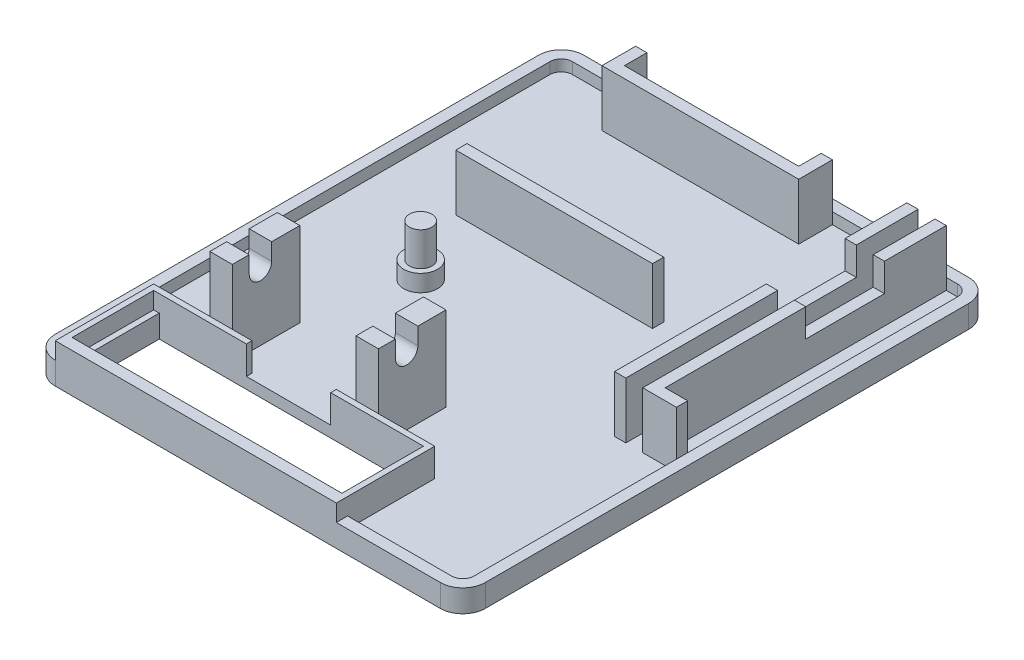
SolidWorks part; units mm, degrees
ref_plane "Plan de face" through (0, 0, 0) normal (0, 0, 1) x (1, 0, 0)
ref_plane "Plan de dessus" through (0, 0, 0) normal (0, 1, 0) x (1, 0, 0)
ref_plane "Plan de droite" through (0, 0, 0) normal (1, 0, 0) x (0, 0, -1)
sketch "Esquisse1" plane through (0, 8.2301, 0) normal (0, -1, 0) x (1, 0, 0)
  line L0 (29.8218, 30.8624) -> (-0.6782, 30.8624) construction
  line L1 (-0.6782, 29.3624) -> (-0.6782, 32.3624) construction
  line L2 (14.5718, 30.8624) -> (14.5718, 42.8624) construction
  line L3 (28.5718, 42.8624) -> (0.5718, 42.8624) construction
  line L4 (-2.9282, 16.8624) -> (32.0718, 18.8624) construction
  line L5 (-2.9282, 42.8624) -> (32.0718, 42.8624)
  line L6 (-2.9282, 42.8624) -> (-2.9282, 44.8624)
  line L7 (-2.9282, 44.8624) -> (32.0718, 44.8624)
  line L8 (32.0718, 42.8624) -> (32.0718, 44.8624)
  line L9 (-2.9282, 42.8624) -> (32.0718, 44.8624) construction
  line L10 (-2.9282, 44.8624) -> (32.0718, 42.8624) construction
  line L11 (-2.9282, 18.8624) -> (32.0718, 16.8624) construction
  line L12 (47.3218, 18.4124) -> (47.3218, 66.4124) construction
  line L13 (-0.9282, 16.8624) -> (30.0718, 16.8624)
  line L14 (-2.9282, 18.8624) -> (-2.9282, 16.8624)
  line L15 (-2.9282, 18.8624) -> (32.0718, 18.8624)
  line L16 (-2.9282, 16.8624) -> (-2.9282, 12.8624)
  line L17 (-2.9282, 12.8624) -> (-0.9282, 12.8624)
  line L18 (-0.9282, 12.8624) -> (-0.9282, 16.8624)
  line L19 (30.0718, 12.8624) -> (30.0718, 16.8624)
  line L20 (32.0718, 12.8624) -> (30.0718, 12.8624)
  line L21 (32.0718, 16.8624) -> (32.0718, 12.8624)
  line L22 (32.0718, 18.8624) -> (32.0718, 16.8624)
  line L23 (45.3218, 12.8624) -> (47.3218, 12.8624)
  line L24 (45.3218, 12.8624) -> (45.3218, 64.8624)
  line L25 (45.3218, 64.8624) -> (47.3218, 64.8624)
  line L26 (47.3218, 12.8624) -> (47.3218, 64.8624)
  line L27 (48.8218, 67.4124) -> (48.8218, 17.4124) construction
  line L28 (47.3218, 67.4124) -> (50.3218, 67.4124) construction
  line L29 (50.3218, 17.4124) -> (47.3218, 17.4124) construction
  line L30 (50.3218, 12.8624) -> (50.3218, 64.8624)
  line L31 (52.3218, 64.8624) -> (50.3218, 64.8624)
  line L32 (52.3218, 12.8624) -> (52.3218, 62.8624)
  line L33 (52.3218, 12.8624) -> (50.3218, 12.8624)
  line L35 (52.3218, 64.8624) -> (56.3218, 64.8624)
  line L37 (52.3218, 62.8624) -> (56.3218, 62.8624)
  line L38 (56.3218, 64.8624) -> (56.3218, 62.8624)
  point P9 (14.5718, 43.8624)
  point P18 (14.5718, 17.8624)
  dimension "D1" = 35
  dimension "D2" = 2
  dimension "D3" = 2
  dimension "D4" = 6
  dimension "D5" = 2
  dimension "D6" = 2
  dimension "D7" = 52
  dimension "D8" = 2
  dimension "D9" = 6
extrude "Boss.-Extru.1" add sketch "Esquisse1" against normal blind 10
sketch "Esquisse2" plane through (52.3218, 0, 0) normal (1, 0, 0) x (0, 0, -1)
  line L0 (-12.8624, 18.2301) -> (-62.8624, 18.2301) construction
  line L1 (-37.8624, 18.2301) -> (-23.8624, 18.2301)
  line L2 (-37.8624, 18.2301) -> (-37.8624, 13.2301)
  line L3 (-37.8624, 13.2301) -> (-23.8624, 13.2301)
  line L4 (-23.8624, 18.2301) -> (-23.8624, 13.2301)
  line L5 (-12.8624, 18.2301) -> (-12.8624, 8.2301) construction
  dimension "D1" = 11
  dimension "D2" = 14
  dimension "D3" = 5
extrude "Enlèv. mat.-Extru.1" cut sketch "Esquisse2" against normal up to surface (7 mm away)
ref_plane "Plan1" through (49.3218, 0, 0) normal (1, 0, 0) x (0, 0, -1)
sketch "Esquisse3" plane through (0, 8.2301, 0) normal (0, -1, 0) x (1, 0, 0)
  line L0 (50.3218, 12.8624) -> (52.3218, 12.8624) construction
  line L1 (54.3218, 12.8624) -> (-14.1782, 12.8624)
  line L2 (56.3218, 14.8624) -> (56.3218, 100.8624)
  line L3 (54.3218, 102.8624) -> (-14.1782, 102.8624)
  line L4 (-16.1782, 14.8624) -> (-16.1782, 100.8624)
  line L5 (56.3218, 62.8624) -> (56.3218, 64.8624) construction
  line L6 (54.3218, 10.8624) -> (-14.1782, 10.8624)
  line L7 (-18.1782, 14.8624) -> (-18.1782, 100.8624)
  line L8 (54.3218, 104.8624) -> (-14.1782, 104.8624)
  line L9 (58.3218, 14.8624) -> (58.3218, 100.8624)
  arc A0 (54.3218, 12.8624) -> (56.3218, 14.8624) centre (54.3218, 14.8624) ccw
  arc A1 (56.3218, 100.8624) -> (54.3218, 102.8624) centre (54.3218, 100.8624) ccw
  arc A2 (-14.1782, 102.8624) -> (-16.1782, 100.8624) centre (-14.1782, 100.8624) ccw
  arc A3 (-16.1782, 14.8624) -> (-14.1782, 12.8624) centre (-14.1782, 14.8624) ccw
  arc A4 (-18.1782, 14.8624) -> (-14.1782, 10.8624) centre (-14.1782, 14.8624) ccw
  arc A5 (-14.1782, 104.8624) -> (-18.1782, 100.8624) centre (-14.1782, 100.8624) ccw
  arc A6 (58.3218, 100.8624) -> (54.3218, 104.8624) centre (54.3218, 100.8624) ccw
  arc A7 (54.3218, 10.8624) -> (58.3218, 14.8624) centre (54.3218, 14.8624) ccw
  dimension "D3" = 2
  dimension "D1" = 72.5
  dimension "D2" = 90
  dimension "D4" = 2
extrude "Boss.-Extru.2" add sketch "Esquisse3" against normal blind 2 separate body
sketch "Esquisse4" plane through (0, 8.2301, 0) normal (0, -1, 0) x (1, 0, 0)
  line L0 (54.3218, 104.8624) -> (-14.1782, 104.8624) construction
  line L1 (54.3218, 104.8624) -> (-14.1782, 104.8624)
  line L2 (-18.1782, 100.8624) -> (-18.1782, 14.8624) construction
  line L3 (-18.1782, 100.8624) -> (-18.1782, 14.8624)
  line L4 (58.3218, 14.8624) -> (58.3218, 100.8624) construction
  line L5 (58.3218, 14.8624) -> (58.3218, 100.8624)
  line L6 (-14.1782, 10.8624) -> (54.3218, 10.8624) construction
  line L7 (-14.1782, 10.8624) -> (54.3218, 10.8624)
  arc A0 (-14.1782, 104.8624) -> (-18.1782, 100.8624) centre (-14.1782, 100.8624) ccw construction
  arc A1 (-14.1782, 104.8624) -> (-18.1782, 100.8624) centre (-14.1782, 100.8624) ccw
  arc A2 (58.3218, 100.8624) -> (54.3218, 104.8624) centre (54.3218, 100.8624) ccw construction
  arc A3 (58.3218, 100.8624) -> (54.3218, 104.8624) centre (54.3218, 100.8624) ccw
  arc A4 (-18.1782, 14.8624) -> (-14.1782, 10.8624) centre (-14.1782, 14.8624) ccw construction
  arc A5 (-18.1782, 14.8624) -> (-14.1782, 10.8624) centre (-14.1782, 14.8624) ccw
  arc A6 (54.3218, 10.8624) -> (58.3218, 14.8624) centre (54.3218, 14.8624) ccw construction
  arc A7 (54.3218, 10.8624) -> (58.3218, 14.8624) centre (54.3218, 14.8624) ccw
extrude "Boss.-Extru.3" add sketch "Esquisse4" along normal blind 2
sketch "Esquisse5" plane through (0, 10.2301, 0) normal (0, 1, 0) x (1, 0, 0)
  line L0 (54.3218, -104.8624) -> (-14.1782, -104.8624) construction
  line L1 (-14.1782, -87.3624) -> (35.8218, -87.3624)
  line L2 (-14.1782, -87.3624) -> (-14.1782, -104.8624)
  line L3 (-14.1782, -104.8624) -> (35.8218, -104.8624)
  line L4 (35.8218, -87.3624) -> (35.8218, -104.8624)
  line L5 (54.3218, -102.8624) -> (-14.1782, -102.8624) construction
  line L6 (-13.1782, -88.3624) -> (34.8218, -88.3624)
  line L7 (-13.1782, -88.3624) -> (-13.1782, -102.8624)
  line L8 (-13.1782, -102.8624) -> (34.8218, -102.8624)
  line L9 (34.8218, -88.3624) -> (34.8218, -102.8624)
  line L11 (-16.1782, -100.8624) -> (-16.1782, -14.8624) construction
  dimension "D1" = 50
  dimension "D2" = 17.5
  dimension "D3" = 1
  dimension "D4" = 1
  dimension "D5" = 1
  dimension "D6" = 2
extrude "Boss.-Extru.4" add sketch "Esquisse5" along normal blind 3 and the other way blind 2
sketch "Esquisse6" plane through (0, 8.2301, 0) normal (0, 1, 0) x (1, 0, 0)
  line L0 (-13.1782, -102.8624) -> (34.8218, -102.8624) construction
  line L1 (33.8218, -101.8624) -> (-12.1782, -101.8624)
  line L2 (33.8218, -101.8624) -> (33.8218, -87.3624)
  line L4 (-12.1782, -101.8624) -> (-12.1782, -87.3624)
  line L5 (34.8218, -102.8624) -> (34.8218, -88.3624) construction
  line L6 (-13.1782, -88.3624) -> (-13.1782, -102.8624) construction
  line L7 (-13.1782, -102.8624) -> (34.8218, -102.8624)
  line L8 (34.8218, -102.8624) -> (34.8218, -87.3624)
  line L9 (-13.1782, -87.3624) -> (-13.1782, -102.8624)
  line L10 (-13.1782, -87.3624) -> (-12.1782, -87.3624)
  line L11 (35.8218, -87.3624) -> (-14.1782, -87.3624) construction
  line L12 (33.8218, -87.3624) -> (34.8218, -87.3624)
  dimension "D1" = 1
  dimension "D2" = 1
  dimension "D3" = 1
extrude "Boss.-Extru.7" add sketch "Esquisse6" along normal up to vertex
sketch "Esquisse7" plane through (0, 0, 87.3624) normal (0, 0, -1) x (-1, 0, 0)
  line L0 (-35.8218, 13.2301) -> (14.1782, 13.2301) construction
  line L1 (-3.3218, 13.2301) -> (-18.3218, 13.2301)
  line L2 (-3.3218, 13.2301) -> (-3.3218, 8.2301)
  line L3 (-35.8218, 8.2301) -> (14.1782, 8.2301) construction
  line L4 (-18.3218, 13.2301) -> (-18.3218, 8.2301)
  line L6 (-35.8218, 8.2301) -> (-35.8218, 13.2301) construction
  line L7 (14.1782, 8.2301) -> (14.1782, 13.2301) construction
  line L8 (-18.3218, 8.2301) -> (-3.3218, 8.2301)
  dimension "D1" = 17.5
  dimension "D2" = 17.5
extrude "Enlèv. mat.-Extru.2" cut sketch "Esquisse7" against normal blind 2
sketch "Esquisse9" plane through (0, 13.2301, 0) normal (0, 1, 0) x (1, 0, 0)
  line L0 (-12.1782, -101.8624) -> (-12.1782, -88.3624) construction
  line L1 (-13.1782, -88.3624) -> (34.8218, -88.3624)
  line L2 (-13.1782, -88.3624) -> (-13.1782, -102.8624)
  line L3 (-13.1782, -102.8624) -> (34.8218, -102.8624)
  line L4 (34.8218, -88.3624) -> (34.8218, -102.8624)
  line L5 (35.8218, -102.8624) -> (35.8218, -87.3624) construction
  line L6 (33.8218, -101.8624) -> (-12.1782, -101.8624) construction
  line L7 (33.8218, -88.3624) -> (18.3218, -88.3624) construction
  dimension "D1" = 1
  dimension "D2" = 1
  dimension "D3" = 1
extrude "Enlèv. mat.-Extru.3" cut sketch "Esquisse9" against normal up to surface (3 mm away)
sketch "Esquisse10" plane through (0, 8.2301, 0) normal (0, 1, 0) x (1, 0, 0)
  line L0 (-12.1782, -101.8624) -> (33.8218, -101.8624) construction
  line L1 (-12.1782, -101.8624) -> (33.8218, -101.8624)
  line L2 (-12.1782, -88.3624) -> (-12.1782, -101.8624) construction
  line L3 (-12.1782, -88.3624) -> (-12.1782, -101.8624)
  line L4 (33.8218, -101.8624) -> (33.8218, -88.3624) construction
  line L5 (33.8218, -101.8624) -> (33.8218, -88.3624)
  line L6 (-12.1782, -88.3624) -> (33.8218, -88.3624)
extrude "Enlèv. mat.-Extru.4" cut sketch "Esquisse10" against normal up to next
sketch "Esquisse11" plane through (0, 8.2301, 0) normal (0, 1, 0) x (1, 0, 0)
  line L0 (32.0718, -44.8624) -> (-2.9282, -44.8624) construction
  line L1 (-16.1782, -100.8624) -> (-16.1782, -14.8624) construction
  circle A0 centre (3.8218, -57.8624) radius 3
  dimension "D1" = 6
  dimension "D2" = 13
  dimension "D3" = 20
extrude "Boss.-Extru.8" add sketch "Esquisse11" along normal blind 3
sketch "Esquisse12" plane through (0, 11.2301, 0) normal (0, 1, 0) x (1, 0, 0)
  circle A0 centre (3.8218, -57.8624) radius 2
  dimension "D1" = 4
extrude "Boss.-Extru.9" add sketch "Esquisse12" along normal blind 6
sketch "Esquisse13" plane through (0, 8.2301, 0) normal (0, 1, 0) x (1, 0, 0)
  line L0 (35.8218, -87.3624) -> (18.3218, -87.3624) construction
  line L1 (10.8218, -88.3624) -> (10.8218, -101.8624) construction
  line L2 (21.8218, -87.3624) -> (25.8218, -87.3624)
  line L3 (21.8218, -87.3624) -> (21.8218, -75.3624)
  line L4 (21.8218, -75.3624) -> (25.8218, -75.3624)
  line L5 (25.8218, -87.3624) -> (25.8218, -75.3624)
  line L6 (18.3218, -88.3624) -> (3.3218, -88.3624) construction
  line L7 (-12.1782, -101.8624) -> (33.8218, -101.8624) construction
  line L8 (-4.1782, -87.3624) -> (-4.1782, -75.3624)
  line L9 (-0.1782, -75.3624) -> (-4.1782, -75.3624)
  line L10 (-0.1782, -87.3624) -> (-0.1782, -75.3624)
  line L11 (-0.1782, -87.3624) -> (-4.1782, -87.3624)
  dimension "D1" = 4
  dimension "D2" = 12
  dimension "D3" = 15
extrude "Boss.-Extru.10" add sketch "Esquisse13" along normal blind 15
sketch "Esquisse14" plane through (25.8218, 0, 0) normal (1, 0, 0) x (0, 0, -1)
  line L0 (-87.3624, 23.2301) -> (-87.3624, 13.2301) construction
  line L1 (-87.3624, 23.2301) -> (-75.3624, 23.2301) construction
  line L2 (-84.3624, 20.2301) -> (-84.3624, 23.2301)
  line L3 (-84.3624, 23.2301) -> (-80.3624, 23.2301)
  line L4 (-80.3624, 23.2301) -> (-80.3624, 20.2301)
  arc A0 (-84.3624, 20.2301) -> (-80.3624, 20.2301) centre (-82.3624, 20.2301) ccw
  dimension "D1" = 4
  dimension "D2" = 5
  dimension "D3" = 3
extrude "Enlèv. mat.-Extru.5" cut sketch "Esquisse14" against normal up to surface (30 mm away)
ref_plane "Plan2" through (10.8218, 0, 0) normal (1, 0, 0) x (0, 0, -1)
